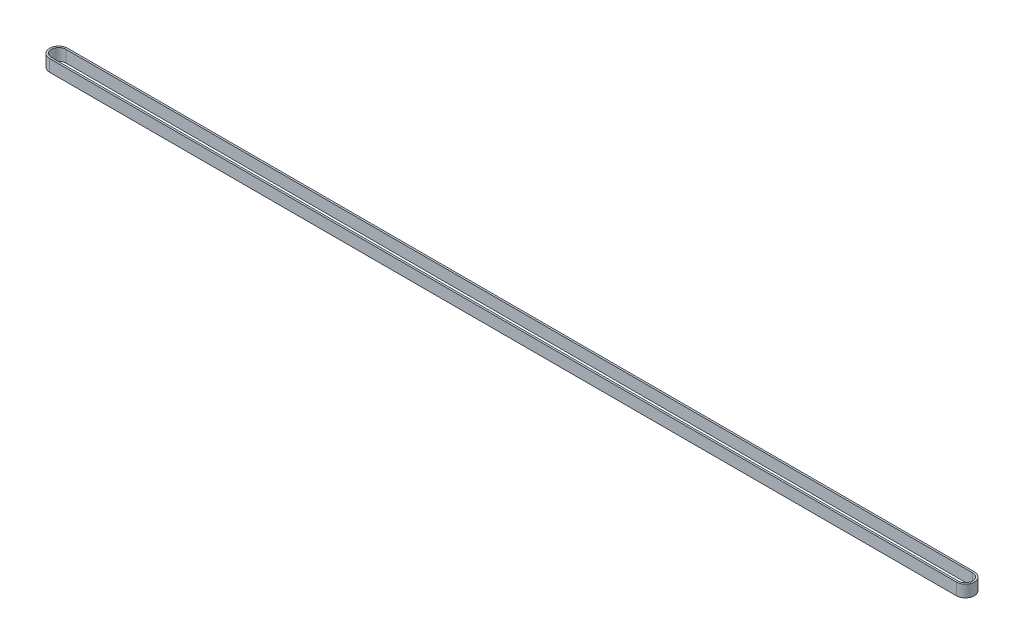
SolidWorks part; units mm, degrees
ref_plane "Ebene vorne" through (0, 0, 0) normal (0, 0, 1) x (1, 0, 0)
ref_plane "Ebene oben" through (0, 0, 0) normal (0, 1, 0) x (1, 0, 0)
ref_plane "Ebene rechts" through (0, 0, 0) normal (1, 0, 0) x (0, 0, -1)
sketch "Skizze1" plane through (0, 0, 0) normal (0, 1, 0) x (1, 0, 0)
  line L0 (758.8, -6.75) -> (0, -6.75) construction
  line L3 (0, 6.75) -> (758.8, 6.75) construction
  line L7 (758.8, -7.5) -> (0, -7.5)
  line L11 (758.8, -6) -> (0, -6)
  line L12 (-3.8114, 31.7366) -> (18.6161, 3.4686) construction
  line L13 (-2.9132, 31.8112) -> (19.0523, 4.1255) construction
  line L14 (-2.0069, 31.8755) -> (19.4893, 4.7814) construction
  line L15 (30.7206, 6) -> (0, 6) construction
  line L16 (30.4077, 6.75) -> (0, 6.75) construction
  line L17 (30.0882, 7.5) -> (0, 7.5) construction
  line L18 (0, 6) -> (758.8, 6) construction
  line L19 (0, 6) -> (758.8, 6)
  line L20 (758.8, 7.5) -> (0, 7.5)
  line L21 (0, 7.5) -> (758.8, 7.5) construction
  arc A0 (0, 6.75) -> (0, -6.75) centre (0, 0) ccw construction
  arc A1 (758.8, -6.75) -> (758.8, 6.75) centre (758.8, 0) ccw construction
  arc A4 (758.8, -7.5) -> (758.8, 7.5) centre (758.8, 0) ccw
  arc A7 (0, 7.5) -> (0, -7.5) centre (0, 0) ccw
  arc A8 (758.8, -6) -> (758.8, 6) centre (758.8, 0) ccw
  arc A11 (0, 6) -> (0, -6) centre (0, 0) ccw
  arc A12 (0, 6) -> (18.6161, 3.4686) centre (0, -63.7168) ccw construction
  arc A13 (0, 6.75) -> (19.0523, 4.1255) centre (0, -63.7168) ccw construction
  arc A14 (0, 7.5) -> (19.4893, 4.7814) centre (0, -63.7168) ccw construction
  arc A15 (30.7206, 6) -> (-3.8114, 31.7366) centre (15.3618, 21.4272) ccw construction
  arc A16 (30.4077, 6.75) -> (-2.9132, 31.8112) centre (15.3618, 21.4272) ccw construction
  arc A17 (30.0882, 7.5) -> (-2.0069, 31.8755) centre (15.3618, 21.4272) ccw construction
  dimension "D1" = 13.5
  dimension "D3" = 758.8
  dimension "D7" = 0.75
  dimension "D8" = 0.75
extrude "Aufsatz-Linear austragen1" add sketch "Skizze1" along normal mid plane 10
